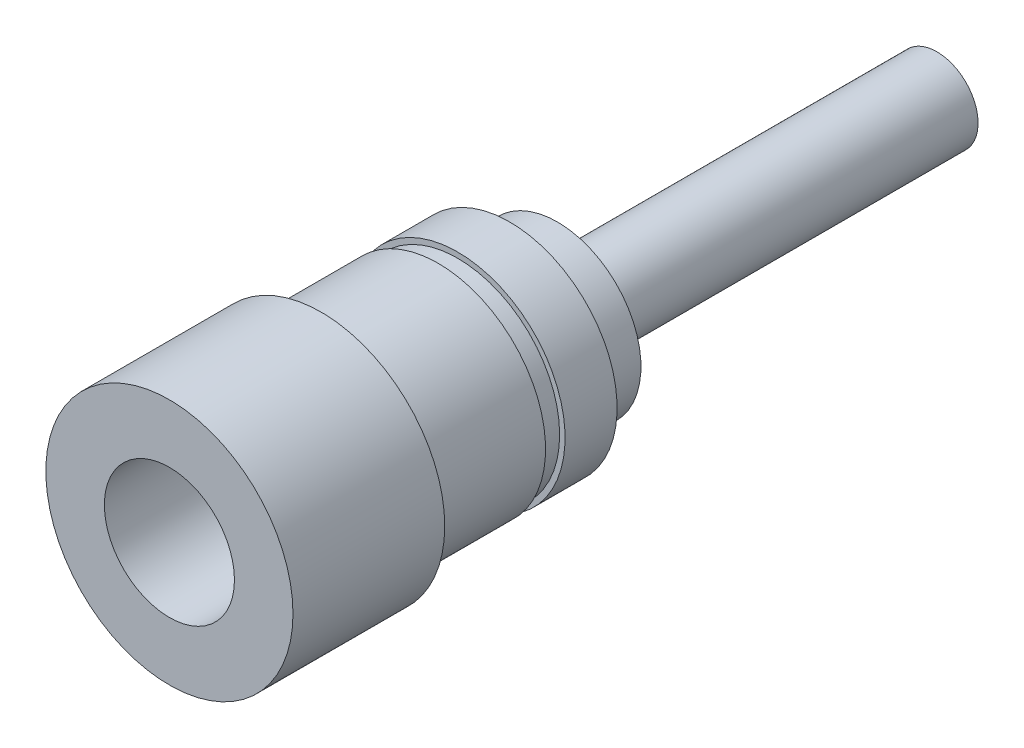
SolidWorks part; units mm, degrees
ref_plane "Front Plane" through (0, 0, 0) normal (0, 0, 1) x (1, 0, 0)
ref_plane "Top Plane" through (0, 0, 0) normal (0, 1, 0) x (1, 0, 0)
ref_plane "Right Plane" through (0, 0, 0) normal (1, 0, 0) x (0, 0, -1)
sketch "Sketch1" plane through (0, 0, 0) normal (0, 0, 1) x (1, 0, 0)
  circle A0 centre (0, 0) radius 4.7
extrude "Boss-Extrude1" add sketch "Sketch1" along normal blind 0.9
sketch "Sketch2" plane through (0, 0, 0.9) normal (0, 0, 1) x (1, 0, 0)
  circle A0 centre (0, 0) radius 2.6
extrude "Boss-Extrude2" add sketch "Sketch2" along normal blind 8.25
sketch "Sketch3" plane through (0, 0, 0) normal (0, 0, -1) x (-1, 0, 0)
  circle A0 centre (0, 0) radius 2.35
extrude "Boss-Extrude3" add sketch "Sketch3" along normal blind 2.6
sketch "Sketch4" plane through (0, 0, -2.6) normal (0, 0, -1) x (-1, 0, 0)
  circle A0 centre (0, 0) radius 1.9
extrude "Boss-Extrude4" add sketch "Sketch4" along normal blind 19.5
sketch "Sketch5" plane through (0, 0, 0) normal (0, 0, -1) x (-1, 0, 0)
  circle A0 centre (0, 0) radius 2.6
  circle A1 centre (0, 0) radius 4.95
extrude "Boss-Extrude5" add sketch "Sketch5" along normal blind 2.4 separate body
sketch "Sketch6" plane through (0, 0, -2.4) normal (0, 0, -1) x (-1, 0, 0)
  circle A0 centre (0, 0) radius 2.6
  circle A1 centre (0, 0) radius 3.85
extrude "Boss-Extrude6" add sketch "Sketch6" along normal blind 2.2 separate body
combine bodies "Combine1" operation type add bodies to combine 105 106
sketch "Sketch7" plane through (0, 0, 0.9) normal (0, 0, 1) x (1, 0, 0)
  circle A0 centre (0, 0) radius 2.6
  circle A1 centre (0, 0) radius 4.95
extrude "Boss-Extrude7" add sketch "Sketch7" along normal blind 5.4 separate body
sketch "Sketch8" plane through (0, 0, 6.3) normal (0, 0, 1) x (1, 0, 0)
  circle A0 centre (0, 0) radius 5.7
extrude "Boss-Extrude8" add sketch "Sketch8" along normal blind 7 separate body
combine bodies "Combine2" operation type add bodies to combine 108 109
sketch "Sketch9" plane through (0, 0, 13.3) normal (0, 0, 1) x (1, 0, 0)
  circle A0 centre (0, 0) radius 3
extrude "Cut-Extrude1" cut sketch "Sketch9" against normal up to next
sketch "Sketch10" plane through (0, 0, 6.3) normal (0, 0, 1) x (1, 0, 0)
  circle A0 centre (0, 0) radius 2
extrude "Cut-Extrude2" cut sketch "Sketch10" against normal blind 7
